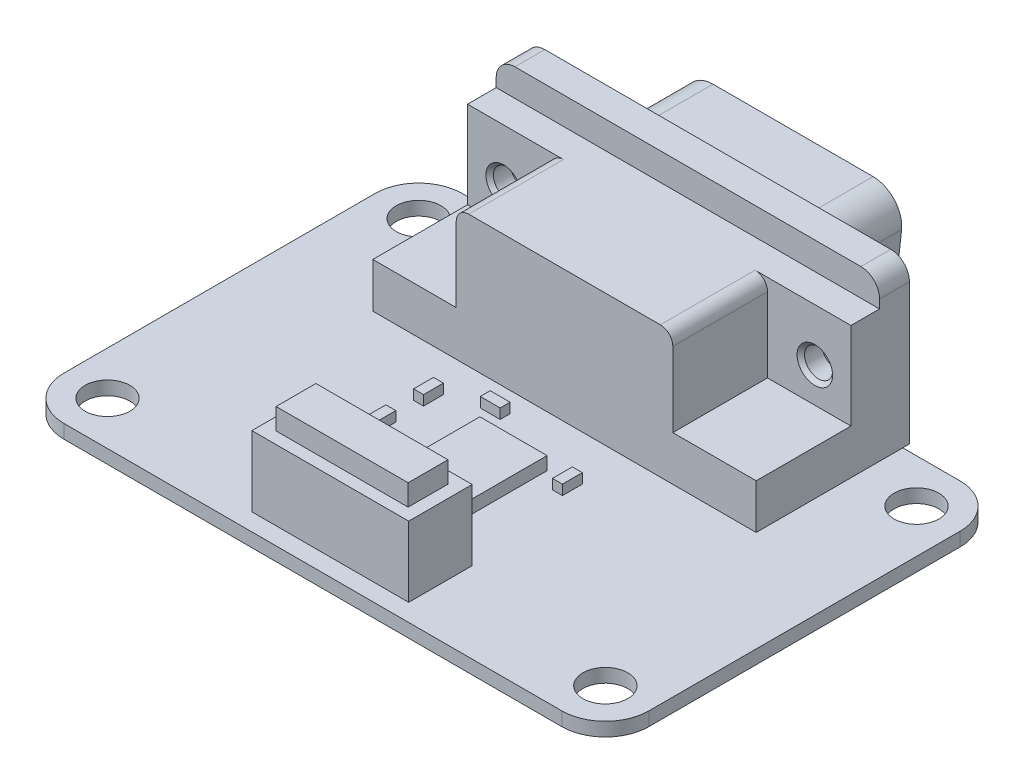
SolidWorks part; units mm, degrees
ref_plane "Front Plane" through (0, 0, 0) normal (0, 0, 1) x (1, 0, 0)
ref_plane "Top Plane" through (0, 0, 0) normal (0, 1, 0) x (1, 0, 0)
ref_plane "Right Plane" through (0, 0, 0) normal (1, 0, 0) x (0, 0, -1)
imported_body "Imported3"
sketch "Sketch1" plane through (-42.1738, 0, 0) normal (-1, 0, 0) x (0, 0, 1)
  line L0 (-17.6735, 0) -> (-15.5735, -1.8908)
  line L1 (-15.5735, -1.8908) -> (-17.6735, -1.8908)
  spline S0 degree 3 poles (-17.6735, -1.8908) (-17.6735, -1.2606) (-17.6735, -0.6303) (-17.6735, 0) knots 0 0 0 0 1 1 1 1
extrude "Boss-Extrude1" add sketch "Sketch1" along normal blind 2.1
sketch "Sketch2" plane through (-44.2738, 0, 0) normal (-1, 0, 0) x (0, 0, 1)
  line L0 (-17.6735, -1.8908) -> (-15.5735, -1.8908)
  line L1 (-15.5735, -1.8908) -> (-17.6735, 0)
  spline S0 degree 3 poles (-17.6735, -1.8908) (-17.6735, -1.2606) (-17.6735, -0.6303) (-17.6735, 0) knots 0 0 0 0 1 1 1 1
extrude "Cut-Extrude1" cut sketch "Sketch2" against normal blind 2.1
sketch "Sketch3" plane through (-16.7738, 0, 0) normal (-1, 0, 0) x (0, 0, 1)
  line L0 (-12.7235, -1.8908) -> (-14.8235, -1.8908)
  line L1 (-14.8235, -1.8908) -> (-12.7235, 0)
  spline S0 degree 3 poles (-12.7235, -1.8908) (-12.7235, -1.2606) (-12.7235, -0.6303) (-12.7235, 0) knots 0 0 0 0 1 1 1 1
extrude "Boss-Extrude2" add sketch "Sketch3" along normal blind 2.1
sketch "Sketch4" plane through (-18.8738, 0, 0) normal (-1, 0, 0) x (0, 0, 1)
  line L0 (-14.8235, -1.8908) -> (-12.7235, -1.8908)
  line L1 (-12.7235, 0) -> (-14.8235, -1.8908)
  spline S0 degree 3 poles (-12.7235, -1.8908) (-12.7235, -1.2606) (-12.7235, -0.6303) (-12.7235, 0) knots 0 0 0 0 1 1 1 1
extrude "Cut-Extrude2" cut sketch "Sketch4" against normal blind 2.1
sketch "Sketch5" plane through (-16.7738, 0, 0) normal (-1, 0, 0) x (0, 0, 1)
  line L0 (-15.5735, -1.8908) -> (-17.6735, -1.8908)
  line L1 (-17.6735, 0) -> (-15.5735, -1.8908)
  spline S0 degree 3 poles (-17.6735, -1.8908) (-17.6735, -1.2606) (-17.6735, -0.6303) (-17.6735, 0) knots 0 0 0 0 1 1 1 1
extrude "Boss-Extrude3" add sketch "Sketch5" along normal blind 2.1
sketch "Sketch6" plane through (-18.8738, 0, 0) normal (-1, 0, 0) x (0, 0, 1)
  line L0 (-17.6735, -1.8908) -> (-15.5735, -1.8908)
  line L1 (-15.5735, -1.8908) -> (-17.6735, 0)
  spline S0 degree 3 poles (-17.6735, -1.8908) (-17.6735, -1.2606) (-17.6735, -0.6303) (-17.6735, 0) knots 0 0 0 0 1 1 1 1
extrude "Cut-Extrude3" cut sketch "Sketch6" against normal blind 2.1
sketch "Sketch7" plane through (-13.6738, 0, 0) normal (1, 0, 0) x (0, 0, -1)
  line L0 (17.6735, -1.8908) -> (15.5735, -1.8908)
  line L1 (15.5735, -1.8908) -> (17.6735, 0)
  spline S0 degree 3 poles (17.6735, -1.8908) (17.6735, -1.2606) (17.6735, -0.6303) (17.6735, 0) knots 0 0 0 0 1 1 1 1
extrude "Boss-Extrude4" add sketch "Sketch7" along normal blind 2.1
sketch "Sketch8" plane through (-11.5738, 0, 0) normal (1, 0, 0) x (0, 0, -1)
  line L0 (15.5735, -1.8908) -> (17.6735, -1.8908)
  line L1 (17.6735, 0) -> (15.5735, -1.8908)
  spline S0 degree 3 poles (17.6735, -1.8908) (17.6735, -1.2606) (17.6735, -0.6303) (17.6735, 0) knots 0 0 0 0 1 1 1 1
extrude "Cut-Extrude4" cut sketch "Sketch8" against normal blind 2.1
sketch "Sketch9" plane through (-13.6738, 0, 0) normal (1, 0, 0) x (0, 0, -1)
  line L0 (12.7235, 0) -> (14.8235, -1.8908)
  line L1 (14.8235, -1.8908) -> (12.7235, -1.8908)
  spline S0 degree 3 poles (12.7235, -1.8908) (12.7235, -1.2606) (12.7235, -0.6303) (12.7235, 0) knots 0 0 0 0 1 1 1 1
extrude "Boss-Extrude5" add sketch "Sketch9" along normal blind 2.1
sketch "Sketch10" plane through (-11.5738, 0, 0) normal (1, 0, 0) x (0, 0, -1)
  line L0 (12.7235, -1.8908) -> (14.8235, -1.8908)
  line L1 (14.8235, -1.8908) -> (12.7235, 0)
  spline S0 degree 3 poles (12.7235, -1.8908) (12.7235, -1.2606) (12.7235, -0.6303) (12.7235, 0) knots 0 0 0 0 1 1 1 1
extrude "Cut-Extrude5" cut sketch "Sketch10" against normal blind 2.1
sketch "Sketch11" plane through (-13.6738, 0, 0) normal (1, 0, 0) x (0, 0, -1)
  line L0 (12.7235, -1.8908) -> (14.8235, -1.8908)
  line L1 (14.8235, -1.8908) -> (12.7235, 0)
  spline S0 degree 3 poles (12.7235, -1.8908) (12.7235, -1.2606) (12.7235, -0.6303) (12.7235, 0) knots 0 0 0 0 1 1 1 1
extrude "Cut-Extrude6" cut sketch "Sketch11" against normal blind 0.6745
sketch "Sketch12" plane through (-14.3483, 0, 0) normal (1, 0, 0) x (0, 0, -1)
  line L0 (12.7235, -1.8908) -> (14.8235, -1.8908)
  line L1 (14.8235, -1.8908) -> (12.7235, 0)
  spline S0 degree 3 poles (12.7235, -1.8908) (12.7235, -1.2606) (12.7235, -0.6303) (12.7235, 0) knots 0 0 0 0 1 1 1 1
extrude "Cut-Extrude7" cut sketch "Sketch12" against normal blind 0.3255
sketch "Sketch13" plane through (-39.0738, 0, 0) normal (1, 0, 0) x (0, 0, -1)
  line L0 (12.7235, 0) -> (14.8235, -1.8908)
  line L1 (14.8235, -1.8908) -> (12.7235, -1.8908)
  spline S0 degree 3 poles (12.7235, -1.8908) (12.7235, -1.2606) (12.7235, -0.6303) (12.7235, 0) knots 0 0 0 0 1 1 1 1
extrude "Boss-Extrude6" add sketch "Sketch13" along normal blind 2.1
sketch "Sketch14" plane through (-36.9738, 0, 0) normal (1, 0, 0) x (0, 0, -1)
  line L0 (12.7235, -1.8908) -> (14.8235, -1.8908)
  line L1 (14.8235, -1.8908) -> (12.7235, 0)
  spline S0 degree 3 poles (12.7235, -1.8908) (12.7235, -1.2606) (12.7235, -0.6303) (12.7235, 0) knots 0 0 0 0 1 1 1 1
extrude "Cut-Extrude8" cut sketch "Sketch14" against normal blind 2.1
sketch "Sketch15" plane through (-42.1738, 0, 0) normal (-1, 0, 0) x (0, 0, 1)
  line L0 (-14.8235, -1.8908) -> (-12.7235, 0)
  line L1 (-12.7235, -1.8908) -> (-14.8235, -1.8908)
  spline S0 degree 3 poles (-12.7235, -1.8908) (-12.7235, -1.2606) (-12.7235, -0.6303) (-12.7235, 0) knots 0 0 0 0 1 1 1 1
extrude "Boss-Extrude7" add sketch "Sketch15" along normal blind 2.1
sketch "Sketch16" plane through (-44.2738, 0, 0) normal (-1, 0, 0) x (0, 0, 1)
  line L0 (-12.7235, 0) -> (-14.8235, -1.8908)
  line L1 (-14.8235, -1.8908) -> (-12.7235, -1.8908)
  spline S0 degree 3 poles (-12.7235, -1.8908) (-12.7235, -1.2606) (-12.7235, -0.6303) (-12.7235, 0) knots 0 0 0 0 1 1 1 1
extrude "Cut-Extrude9" cut sketch "Sketch16" against normal blind 2.1
sketch "Sketch17" plane through (-11.5738, 0, 0) normal (1, 0, 0) x (0, 0, -1)
  line L0 (12.7235, 1.1) -> (17.6735, 1.1)
  line L1 (17.6735, 1.1) -> (17.6735, 0)
  line L2 (17.6735, 0) -> (12.7235, 0)
  line L3 (12.7235, 0) -> (12.7235, 1.1)
extrude "Boss-Extrude8" add sketch "Sketch17" along normal blind 7.15
sketch "Sketch18" plane through (-39.0738, 0, 0) normal (1, 0, 0) x (0, 0, -1)
  line L0 (17.6735, -1.8908) -> (15.5735, -1.8908)
  line L1 (15.5735, -1.8908) -> (17.6735, 0)
  spline S0 degree 3 poles (17.6735, -1.8908) (17.6735, -1.2606) (17.6735, -0.6303) (17.6735, 0) knots 0 0 0 0 1 1 1 1
extrude "Boss-Extrude9" add sketch "Sketch18" along normal blind 2.1
sketch "Sketch19" plane through (-36.9738, 0, 0) normal (1, 0, 0) x (0, 0, -1)
  line L0 (15.5735, -1.8908) -> (17.6735, -1.8908)
  line L1 (17.6735, 0) -> (15.5735, -1.8908)
  spline S0 degree 3 poles (17.6735, -1.8908) (17.6735, -1.2606) (17.6735, -0.6303) (17.6735, 0) knots 0 0 0 0 1 1 1 1
extrude "Cut-Extrude10" cut sketch "Sketch19" against normal blind 2.1
sketch "Sketch20" plane through (-39.0738, 0, 0) normal (1, 0, 0) x (0, 0, -1)
  line L0 (15.5735, -1.8908) -> (17.6735, -1.8908)
  line L1 (17.6735, 0) -> (15.5735, -1.8908)
  spline S0 degree 3 poles (17.6735, -1.8908) (17.6735, -1.2606) (17.6735, -0.6303) (17.6735, 0) knots 0 0 0 0 1 1 1 1
extrude "Cut-Extrude11" cut sketch "Sketch20" against normal blind 0.6745
sketch "Sketch21" plane through (-39.7483, 0, 0) normal (1, 0, 0) x (0, 0, -1)
  line L0 (15.5735, -1.8908) -> (17.6735, -1.8908)
  line L1 (17.6735, 0) -> (15.5735, -1.8908)
  spline S0 degree 3 poles (17.6735, -1.8908) (17.6735, -1.2606) (17.6735, -0.6303) (17.6735, 0) knots 0 0 0 0 1 1 1 1
extrude "Cut-Extrude12" cut sketch "Sketch21" against normal blind 0.3255
sketch "Sketch22" plane through (0, -1.8908, 0) normal (0, -1, 0) x (1, 0, 0)
  line L0 (-42.1738, -14.8235) -> (-42.1738, -12.7235)
  line L1 (-41.1738, -12.7235) -> (-40.0738, -12.7235)
  line L2 (-39.0738, -12.7235) -> (-39.0738, -14.8235)
  line L3 (-39.7483, -15.5735) -> (-40.0738, -15.5735)
  line L4 (-40.0738, -15.5735) -> (-40.0738, -17.6735)
  line L5 (-40.0738, -17.6735) -> (-41.1738, -17.6735)
  line L6 (-42.1738, -17.6735) -> (-42.1738, -15.5735)
  spline S0 degree 3 poles (-42.1738, -15.5735) (-42.1738, -15.3235) (-42.1738, -15.0735) (-42.1738, -14.8235) knots 0 0 0 0 1 1 1 1
  spline S1 degree 3 poles (-42.1738, -12.7235) (-41.9489, -12.7235) (-41.7241, -12.7235) (-41.4993, -12.7235) knots 0 0 0 0 1 1 1 1
  spline S2 degree 3 poles (-41.4993, -12.7235) (-41.3908, -12.7235) (-41.2823, -12.7235) (-41.1738, -12.7235) knots 0 0 0 0 1 1 1 1
  spline S3 degree 3 poles (-39.7483, -12.7235) (-39.8568, -12.7235) (-39.9653, -12.7235) (-40.0738, -12.7235) knots 0 0 0 0 1 1 1 1
  spline S4 degree 3 poles (-39.0738, -12.7235) (-39.2986, -12.7235) (-39.5235, -12.7235) (-39.7483, -12.7235) knots 0 0 0 0 1 1 1 1
  spline S5 degree 3 poles (-39.0738, -15.5735) (-39.0738, -15.3235) (-39.0738, -15.0735) (-39.0738, -14.8235) knots 0 0 0 0 1 1 1 1
  spline S6 degree 3 poles (-39.0738, -15.5735) (-39.2986, -15.5735) (-39.5235, -15.5735) (-39.7483, -15.5735) knots 0 0 0 0 1 1 1 1
  spline S7 degree 3 poles (-41.4993, -17.6735) (-41.3908, -17.6735) (-41.2823, -17.6735) (-41.1738, -17.6735) knots 0 0 0 0 1 1 1 1
  spline S8 degree 3 poles (-42.1738, -17.6735) (-41.9489, -17.6735) (-41.7241, -17.6735) (-41.4993, -17.6735) knots 0 0 0 0 1 1 1 1
extrude "Boss-Extrude10" add sketch "Sketch22" along normal blind 1.0092
sketch "Sketch23" plane through (-42.1738, 0, 0) normal (-1, 0, 0) x (0, 0, 1)
  line L0 (-17.6735, -2.9) -> (-15.5735, -2.9)
  line L1 (-15.5735, -2.9) -> (-15.5735, -1.8908)
  line L2 (-15.5735, -1.8908) -> (-17.6735, 0)
  spline S0 degree 3 poles (-17.6735, -1.8908) (-17.6735, -1.2606) (-17.6735, -0.6303) (-17.6735, 0) knots 0 0 0 0 1 1 1 1
  spline S1 degree 3 poles (-17.6735, -2.9) (-17.6735, -2.5636) (-17.6735, -2.2272) (-17.6735, -1.8908) knots 0 0 0 0 1 1 1 1
extrude "Cut-Extrude13" cut sketch "Sketch23" against normal blind 0.6745
sketch "Sketch24" plane through (-41.4993, 0, 0) normal (-1, 0, 0) x (0, 0, 1)
  line L0 (-17.6735, -2.9) -> (-15.5735, -2.9)
  line L1 (-15.5735, -2.9) -> (-15.5735, -1.8908)
  line L2 (-15.5735, -1.8908) -> (-17.6735, 0)
  spline S0 degree 3 poles (-17.6735, -1.8908) (-17.6735, -1.2606) (-17.6735, -0.6303) (-17.6735, 0) knots 0 0 0 0 1 1 1 1
  spline S1 degree 3 poles (-17.6735, -2.9) (-17.6735, -2.5636) (-17.6735, -2.2272) (-17.6735, -1.8908) knots 0 0 0 0 1 1 1 1
extrude "Cut-Extrude14" cut sketch "Sketch24" against normal blind 0.3255
sketch "Sketch25" plane through (0, 0, -15.5735) normal (0, 0, -1) x (-1, 0, 0)
  line L0 (39.7483, -2.9) -> (39.0738, -1.9)
  line L1 (39.0738, -1.9) -> (39.0738, -2.9)
  spline S0 degree 3 poles (39.0738, -2.9) (39.2986, -2.9) (39.5235, -2.9) (39.7483, -2.9) knots 0 0 0 0 1 1 1 1
extrude "Cut-Extrude15" cut sketch "Sketch25" against normal blind 0.75
sketch "Sketch26" plane through (0, 0, -15.5735) normal (0, 0, -1) x (-1, 0, 0)
  line L0 (42.1738, -1.9) -> (41.4993, -2.9)
  line L1 (42.1738, -2.9) -> (42.1738, -1.9)
  spline S0 degree 3 poles (42.1738, -2.9) (41.9489, -2.9) (41.7241, -2.9) (41.4993, -2.9) knots 0 0 0 0 1 1 1 1
extrude "Cut-Extrude16" cut sketch "Sketch26" against normal blind 0.75
sketch "Sketch27" plane through (-39.0738, 0, 0) normal (1, 0, 0) x (0, 0, -1)
  line L0 (12.7235, -2.9) -> (14.8235, -2.9)
  line L1 (14.8235, -2.9) -> (14.8235, -1.8908)
  line L2 (14.8235, -1.8908) -> (12.7235, 0)
  spline S0 degree 3 poles (12.7235, -1.8908) (12.7235, -1.2606) (12.7235, -0.6303) (12.7235, 0) knots 0 0 0 0 1 1 1 1
  spline S1 degree 3 poles (12.7235, -2.9) (12.7235, -2.5636) (12.7235, -2.2272) (12.7235, -1.8908) knots 0 0 0 0 1 1 1 1
extrude "Cut-Extrude17" cut sketch "Sketch27" against normal blind 0.6745
sketch "Sketch28" plane through (-39.7483, 0, 0) normal (1, 0, 0) x (0, 0, -1)
  line L0 (12.7235, -2.9) -> (14.8235, -2.9)
  line L1 (14.8235, -2.9) -> (14.8235, -1.8908)
  line L2 (14.8235, -1.8908) -> (12.7235, 0)
  spline S0 degree 3 poles (12.7235, -1.8908) (12.7235, -1.2606) (12.7235, -0.6303) (12.7235, 0) knots 0 0 0 0 1 1 1 1
  spline S1 degree 3 poles (12.7235, -2.9) (12.7235, -2.5636) (12.7235, -2.2272) (12.7235, -1.8908) knots 0 0 0 0 1 1 1 1
extrude "Cut-Extrude18" cut sketch "Sketch28" against normal blind 0.3255
sketch "Sketch29" plane through (-42.1738, 0, 0) normal (-1, 0, 0) x (0, 0, 1)
  line L0 (-12.7235, 0) -> (-14.8235, -1.8908)
  line L1 (-14.8235, -1.8908) -> (-14.8235, -2.9)
  line L2 (-14.8235, -2.9) -> (-12.7235, -2.9)
  spline S0 degree 3 poles (-12.7235, -1.8908) (-12.7235, -1.2606) (-12.7235, -0.6303) (-12.7235, 0) knots 0 0 0 0 1 1 1 1
  spline S1 degree 3 poles (-12.7235, -2.9) (-12.7235, -2.5636) (-12.7235, -2.2272) (-12.7235, -1.8908) knots 0 0 0 0 1 1 1 1
extrude "Cut-Extrude19" cut sketch "Sketch29" against normal blind 0.6745
sketch "Sketch30" plane through (-41.4993, 0, 0) normal (-1, 0, 0) x (0, 0, 1)
  line L0 (-12.7235, 0) -> (-14.8235, -1.8908)
  line L1 (-14.8235, -1.8908) -> (-14.8235, -2.9)
  line L2 (-14.8235, -2.9) -> (-12.7235, -2.9)
  spline S0 degree 3 poles (-12.7235, -1.8908) (-12.7235, -1.2606) (-12.7235, -0.6303) (-12.7235, 0) knots 0 0 0 0 1 1 1 1
  spline S1 degree 3 poles (-12.7235, -2.9) (-12.7235, -2.5636) (-12.7235, -2.2272) (-12.7235, -1.8908) knots 0 0 0 0 1 1 1 1
extrude "Cut-Extrude20" cut sketch "Sketch30" against normal blind 0.3255
sketch "Sketch31" plane through (0, -1.8908, 0) normal (0, -1, 0) x (1, 0, 0)
  line L0 (-13.6738, -15.5735) -> (-13.6738, -17.6735)
  line L1 (-14.6738, -17.6735) -> (-15.7738, -17.6735)
  line L2 (-16.7738, -17.6735) -> (-16.7738, -15.5735)
  line L3 (-16.7738, -14.8235) -> (-16.7738, -12.7235)
  line L4 (-15.7738, -12.7235) -> (-14.6738, -12.7235)
  line L5 (-14.6738, -12.7235) -> (-14.6738, -14.8235)
  line L6 (-14.6738, -14.8235) -> (-14.3483, -14.8235)
  spline S0 degree 3 poles (-13.6738, -14.8235) (-13.8986, -14.8235) (-14.1235, -14.8235) (-14.3483, -14.8235) knots 0 0 0 0 1 1 1 1
  spline S1 degree 3 poles (-13.6738, -14.8235) (-13.6738, -15.0735) (-13.6738, -15.3235) (-13.6738, -15.5735) knots 0 0 0 0 1 1 1 1
  spline S2 degree 3 poles (-13.6738, -17.6735) (-13.8986, -17.6735) (-14.1235, -17.6735) (-14.3483, -17.6735) knots 0 0 0 0 1 1 1 1
  spline S3 degree 3 poles (-14.3483, -17.6735) (-14.4568, -17.6735) (-14.5653, -17.6735) (-14.6738, -17.6735) knots 0 0 0 0 1 1 1 1
  spline S4 degree 3 poles (-16.0993, -17.6735) (-15.9908, -17.6735) (-15.8823, -17.6735) (-15.7738, -17.6735) knots 0 0 0 0 1 1 1 1
  spline S5 degree 3 poles (-16.7738, -17.6735) (-16.5489, -17.6735) (-16.3241, -17.6735) (-16.0993, -17.6735) knots 0 0 0 0 1 1 1 1
  spline S6 degree 3 poles (-16.7738, -15.5735) (-16.7738, -15.3235) (-16.7738, -15.0735) (-16.7738, -14.8235) knots 0 0 0 0 1 1 1 1
  spline S7 degree 3 poles (-16.7738, -12.7235) (-16.5489, -12.7235) (-16.3241, -12.7235) (-16.0993, -12.7235) knots 0 0 0 0 1 1 1 1
  spline S8 degree 3 poles (-16.0993, -12.7235) (-15.9908, -12.7235) (-15.8823, -12.7235) (-15.7738, -12.7235) knots 0 0 0 0 1 1 1 1
extrude "Boss-Extrude11" add sketch "Sketch31" along normal blind 1.0092
sketch "Sketch32" plane through (-16.7738, 0, 0) normal (-1, 0, 0) x (0, 0, 1)
  line L0 (-17.6735, -2.9) -> (-15.5735, -2.9)
  line L1 (-15.5735, -2.9) -> (-15.5735, -1.8908)
  line L2 (-15.5735, -1.8908) -> (-17.6735, 0)
  spline S0 degree 3 poles (-17.6735, -1.8908) (-17.6735, -1.2606) (-17.6735, -0.6303) (-17.6735, 0) knots 0 0 0 0 1 1 1 1
  spline S1 degree 3 poles (-17.6735, -2.9) (-17.6735, -2.5636) (-17.6735, -2.2272) (-17.6735, -1.8908) knots 0 0 0 0 1 1 1 1
extrude "Cut-Extrude21" cut sketch "Sketch32" against normal blind 0.6745
sketch "Sketch33" plane through (-16.0993, 0, 0) normal (-1, 0, 0) x (0, 0, 1)
  line L0 (-17.6735, -2.9) -> (-15.5735, -2.9)
  line L1 (-15.5735, -2.9) -> (-15.5735, -1.8908)
  line L2 (-15.5735, -1.8908) -> (-17.6735, 0)
  spline S0 degree 3 poles (-17.6735, -1.8908) (-17.6735, -1.2606) (-17.6735, -0.6303) (-17.6735, 0) knots 0 0 0 0 1 1 1 1
  spline S1 degree 3 poles (-17.6735, -2.9) (-17.6735, -2.5636) (-17.6735, -2.2272) (-17.6735, -1.8908) knots 0 0 0 0 1 1 1 1
extrude "Cut-Extrude22" cut sketch "Sketch33" against normal blind 0.3255
sketch "Sketch34" plane through (0, 0, -14.8235) normal (0, 0, 1) x (1, 0, 0)
  line L0 (-13.6738, -2.9) -> (-13.6738, -1.9)
  line L1 (-13.6738, -1.9) -> (-14.3483, -2.9)
  spline S0 degree 3 poles (-13.6738, -2.9) (-13.8986, -2.9) (-14.1235, -2.9) (-14.3483, -2.9) knots 0 0 0 0 1 1 1 1
extrude "Cut-Extrude23" cut sketch "Sketch34" against normal blind 0.75
sketch "Sketch35" plane through (0, 0, -15.5735) normal (0, 0, -1) x (-1, 0, 0)
  line L0 (16.7738, -2.9) -> (16.7738, -1.9)
  line L1 (16.7738, -1.9) -> (16.0993, -2.9)
  spline S0 degree 3 poles (16.7738, -2.9) (16.5489, -2.9) (16.3241, -2.9) (16.0993, -2.9) knots 0 0 0 0 1 1 1 1
extrude "Cut-Extrude24" cut sketch "Sketch35" against normal blind 0.75
sketch "Sketch36" plane through (-13.6738, 0, 0) normal (1, 0, 0) x (0, 0, -1)
  line L0 (17.6735, 0) -> (15.5735, -1.8908)
  line L1 (15.5735, -1.8908) -> (15.5735, -2.9)
  line L2 (15.5735, -2.9) -> (17.6735, -2.9)
  spline S0 degree 3 poles (17.6735, -1.8908) (17.6735, -1.2606) (17.6735, -0.6303) (17.6735, 0) knots 0 0 0 0 1 1 1 1
  spline S1 degree 3 poles (17.6735, -2.9) (17.6735, -2.5636) (17.6735, -2.2272) (17.6735, -1.8908) knots 0 0 0 0 1 1 1 1
extrude "Cut-Extrude25" cut sketch "Sketch36" against normal blind 0.6745
sketch "Sketch37" plane through (-14.3483, 0, 0) normal (1, 0, 0) x (0, 0, -1)
  line L0 (17.6735, 0) -> (15.5735, -1.8908)
  line L1 (15.5735, -1.8908) -> (15.5735, -2.9)
  line L2 (15.5735, -2.9) -> (17.6735, -2.9)
  spline S0 degree 3 poles (17.6735, -1.8908) (17.6735, -1.2606) (17.6735, -0.6303) (17.6735, 0) knots 0 0 0 0 1 1 1 1
  spline S1 degree 3 poles (17.6735, -2.9) (17.6735, -2.5636) (17.6735, -2.2272) (17.6735, -1.8908) knots 0 0 0 0 1 1 1 1
extrude "Cut-Extrude26" cut sketch "Sketch37" against normal blind 0.3255
sketch "Sketch38" plane through (-16.7738, 0, 0) normal (-1, 0, 0) x (0, 0, 1)
  line L0 (-12.7235, 0) -> (-14.8235, -1.8908)
  line L1 (-14.8235, -1.8908) -> (-14.8235, -2.9)
  line L2 (-14.8235, -2.9) -> (-12.7235, -2.9)
  spline S0 degree 3 poles (-12.7235, -1.8908) (-12.7235, -1.2606) (-12.7235, -0.6303) (-12.7235, 0) knots 0 0 0 0 1 1 1 1
  spline S1 degree 3 poles (-12.7235, -2.9) (-12.7235, -2.5636) (-12.7235, -2.2272) (-12.7235, -1.8908) knots 0 0 0 0 1 1 1 1
extrude "Cut-Extrude27" cut sketch "Sketch38" against normal blind 0.6745
sketch "Sketch39" plane through (-16.0993, 0, 0) normal (-1, 0, 0) x (0, 0, 1)
  line L0 (-12.7235, 0) -> (-14.8235, -1.8908)
  line L1 (-14.8235, -1.8908) -> (-14.8235, -2.9)
  line L2 (-14.8235, -2.9) -> (-12.7235, -2.9)
  spline S0 degree 3 poles (-12.7235, -1.8908) (-12.7235, -1.2606) (-12.7235, -0.6303) (-12.7235, 0) knots 0 0 0 0 1 1 1 1
  spline S1 degree 3 poles (-12.7235, -2.9) (-12.7235, -2.5636) (-12.7235, -2.2272) (-12.7235, -1.8908) knots 0 0 0 0 1 1 1 1
extrude "Cut-Extrude28" cut sketch "Sketch39" against normal blind 0.3255
sketch "Sketch40" plane through (0, -2.9, 0) normal (0, -1, 0) x (1, 0, 0)
  line L0 (-14.6738, -14.8235) -> (-14.6738, -12.7235)
  line L1 (-14.6738, -12.7235) -> (-15.7738, -12.7235)
  line L2 (-15.7738, -12.7235) -> (-15.7738, -14.8235)
  line L3 (-15.7738, -14.8235) -> (-15.7738, -15.5735)
  line L4 (-15.7738, -15.5735) -> (-15.7738, -17.6735)
  line L5 (-15.7738, -17.6735) -> (-14.6738, -17.6735)
  line L6 (-14.6738, -17.6735) -> (-14.6738, -15.5735)
  line L7 (-14.6738, -15.5735) -> (-14.6738, -14.8235)
extrude "Cut-Extrude29" cut sketch "Sketch40" against normal blind 1.0092
sketch "Sketch41" plane through (0, -1.8908, 0) normal (0, -1, 0) x (1, 0, 0)
  line L0 (-14.6738, -17.6735) -> (-14.6738, -12.7235)
  line L1 (-14.6738, -12.7235) -> (-15.7738, -12.7235)
  line L2 (-15.7738, -12.7235) -> (-15.7738, -17.6735)
  line L3 (-15.7738, -17.6735) -> (-14.6738, -17.6735)
extrude "Cut-Extrude30" cut sketch "Sketch41" against normal blind 1.8908
sketch "Sketch42" plane through (0, -2.9, 0) normal (0, -1, 0) x (1, 0, 0)
  line L0 (-40.0738, -14.8235) -> (-40.0738, -12.7235)
  line L1 (-40.0738, -12.7235) -> (-41.1738, -12.7235)
  line L2 (-41.1738, -12.7235) -> (-41.1738, -14.8235)
  line L3 (-41.1738, -14.8235) -> (-41.1738, -15.5735)
  line L4 (-41.1738, -15.5735) -> (-41.1738, -17.6735)
  line L5 (-41.1738, -17.6735) -> (-40.0738, -17.6735)
  line L6 (-40.0738, -17.6735) -> (-40.0738, -15.5735)
  line L7 (-40.0738, -15.5735) -> (-40.0738, -14.8235)
extrude "Cut-Extrude31" cut sketch "Sketch42" against normal blind 1.0092
sketch "Sketch43" plane through (0, -1.8908, 0) normal (0, -1, 0) x (1, 0, 0)
  line L0 (-40.0738, -17.6735) -> (-40.0738, -12.7235)
  line L1 (-40.0738, -12.7235) -> (-41.1738, -12.7235)
  line L2 (-41.1738, -12.7235) -> (-41.1738, -17.6735)
  line L3 (-41.1738, -17.6735) -> (-40.0738, -17.6735)
extrude "Cut-Extrude32" cut sketch "Sketch43" against normal blind 1.8908
sketch "Sketch44" plane through (0, 0, -12.7235) normal (0, 0, 1) x (1, 0, 0)
  line L0 (-44.2738, 1.1) -> (-4.4238, 1.1)
  line L1 (-4.4238, 1.1) -> (-4.4238, 0)
  line L2 (-4.4238, 0) -> (-44.2738, 0)
  line L3 (-44.2738, 0) -> (-44.2738, 1.1)
extrude "Boss-Extrude12" add sketch "Sketch44" along normal blind 20.45
sketch "Sketch45" plane through (0, 0, -17.6735) normal (0, 0, -1) x (-1, 0, 0)
  line L0 (44.2738, 0) -> (4.4238, 0)
  line L1 (4.4238, 0) -> (4.4238, 1.1)
  line L2 (4.4238, 1.1) -> (44.2738, 1.1)
  line L3 (44.2738, 1.1) -> (44.2738, 0)
extrude "Boss-Extrude13" add sketch "Sketch45" along normal blind 6.6
sketch "Sketch46" plane through (-44.2738, 0, 0) normal (-1, 0, 0) x (0, 0, 1)
  line L0 (-24.2735, 1.1) -> (7.7265, 1.1)
  line L1 (7.7265, 1.1) -> (7.7265, 0)
  line L2 (7.7265, 0) -> (-24.2735, 0)
  line L3 (-24.2735, 0) -> (-24.2735, 1.1)
extrude "Boss-Extrude14" add sketch "Sketch46" along normal blind 7.15
sketch "Sketch47" plane through (0, 1.1, 0) normal (0, 1, 0) x (-1, 0, 0)
  line L0 (43.3238, -12.4935) -> (43.3238, -24.8035)
  line L1 (43.3238, -24.8035) -> (12.5238, -24.8035)
  line L2 (12.5238, -24.8035) -> (12.5238, -12.4935)
  line L3 (12.5238, -12.4935) -> (43.3238, -12.4935)
extrude "Boss-Extrude15" add sketch "Sketch47" along normal blind 12.8
sketch "Sketch48" plane through (-43.3238, 0, 0) normal (-1, 0, 0) x (0, 0, 1)
  line L0 (-22.4035, 13.9) -> (-22.4035, 11.7)
  line L1 (-22.4035, 11.7) -> (-12.4935, 11.7)
  line L2 (-12.4935, 11.7) -> (-12.4935, 13.9)
  line L3 (-12.4935, 13.9) -> (-22.4035, 13.9)
extrude "Cut-Extrude33" cut sketch "Sketch48" against normal through all
sketch "Sketch49" plane through (0, 11.7, 0) normal (0, 1, 0) x (-1, 0, 0)
  line L0 (12.5238, -12.4935) -> (12.5238, -20.1035)
  line L1 (12.5238, -20.1035) -> (19.2238, -20.1035)
  line L2 (19.2238, -20.1035) -> (19.2238, -12.4935)
  line L3 (19.2238, -12.4935) -> (12.5238, -12.4935)
extrude "Cut-Extrude34" cut sketch "Sketch49" against normal blind 7
sketch "Sketch50" plane through (0, 11.7, 0) normal (0, 1, 0) x (-1, 0, 0)
  line L0 (43.3238, -12.4935) -> (36.6238, -12.4935)
  line L1 (36.6238, -12.4935) -> (36.6238, -20.1035)
  line L2 (36.6238, -20.1035) -> (43.3238, -20.1035)
  line L3 (43.3238, -20.1035) -> (43.3238, -12.4935)
extrude "Cut-Extrude35" cut sketch "Sketch50" against normal blind 7
sketch "Sketch51" plane through (0, 1.1, 0) normal (0, 1, 0) x (-1, 0, 0)
  line L0 (21.6238, 1.2265) -> (21.6238, 6.3265)
  line L1 (21.6238, 6.3265) -> (34.2238, 6.3265)
  line L2 (34.2238, 6.3265) -> (34.2238, 1.2265)
  line L3 (34.2238, 1.2265) -> (21.6238, 1.2265)
extrude "Boss-Extrude16" add sketch "Sketch51" along normal blind 5.65
sketch "Sketch52" plane through (0, 6.75, 0) normal (0, 1, 0) x (-1, 0, 0)
  line L0 (33.2288, 2.1765) -> (22.6188, 2.1765)
  line L1 (22.6188, 2.1765) -> (22.6188, 5.3765)
  line L2 (22.6188, 5.3765) -> (33.2288, 5.3765)
  line L3 (33.2288, 5.3765) -> (33.2288, 2.1765)
extrude "Boss-Extrude17" add sketch "Sketch52" along normal blind 1.7
sketch "Sketch53" plane through (0, 1.1, 0) normal (0, 1, 0) x (-1, 0, 0)
  line L0 (34.6838, -4.0985) -> (35.4838, -4.0985)
  line L1 (35.4838, -4.0985) -> (35.4838, -5.6985)
  line L2 (35.4838, -5.6985) -> (34.6838, -5.6985)
  line L3 (34.6838, -5.6985) -> (34.6838, -4.0985)
extrude "Boss-Extrude18" add sketch "Sketch53" along normal blind 0.8
sketch "Sketch54" plane through (0, 1.1, 0) normal (0, 1, 0) x (-1, 0, 0)
  line L0 (35.4838, -1.8735) -> (34.6838, -1.8735)
  line L1 (34.6838, -1.8735) -> (34.6838, -0.2735)
  line L2 (34.6838, -0.2735) -> (35.4838, -0.2735)
  line L3 (35.4838, -0.2735) -> (35.4838, -1.8735)
extrude "Boss-Extrude19" add sketch "Sketch54" along normal blind 0.8
sketch "Sketch55" plane through (0, 1.1, 0) normal (0, 1, 0) x (-1, 0, 0)
  line L0 (25.2238, -8.3935) -> (25.2238, -1.9935)
  line L1 (25.2238, -1.9935) -> (30.6238, -1.9935)
  line L2 (30.6238, -1.9935) -> (30.6238, -8.3935)
  line L3 (30.6238, -8.3935) -> (25.2238, -8.3935)
extrude "Boss-Extrude20" add sketch "Sketch55" along normal blind 1.05
sketch "Sketch56" plane through (0, 1.1, 0) normal (0, 1, 0) x (-1, 0, 0)
  line L0 (34.6838, -7.9235) -> (35.4838, -7.9235)
  line L1 (35.4838, -7.9235) -> (35.4838, -9.5235)
  line L2 (35.4838, -9.5235) -> (34.6838, -9.5235)
  line L3 (34.6838, -9.5235) -> (34.6838, -7.9235)
extrude "Boss-Extrude21" add sketch "Sketch56" along normal blind 0.8
sketch "Sketch57" plane through (0, 1.1, 0) normal (0, 1, 0) x (-1, 0, 0)
  line L0 (30.6738, -10.8735) -> (30.6738, -10.0735)
  line L1 (30.6738, -10.0735) -> (32.2738, -10.0735)
  line L2 (32.2738, -10.0735) -> (32.2738, -10.8735)
  line L3 (32.2738, -10.8735) -> (30.6738, -10.8735)
extrude "Boss-Extrude22" add sketch "Sketch57" along normal blind 0.8
sketch "Sketch58" plane through (0, 1.1, 0) normal (0, 1, 0) x (-1, 0, 0)
  line L0 (22.8738, -8.8735) -> (22.8738, -7.2735)
  line L1 (22.8738, -7.2735) -> (23.6738, -7.2735)
  line L2 (23.6738, -7.2735) -> (23.6738, -8.8735)
  line L3 (23.6738, -8.8735) -> (22.8738, -8.8735)
extrude "Boss-Extrude23" add sketch "Sketch58" along normal blind 0.8
sketch "Sketch59" plane through (0, 0, 0) normal (0, -1, 0) x (1, 0, 0)
  line L0 (-33.2938, -14.3235) -> (-33.7938, -14.3235)
  line L1 (-33.7938, -14.3235) -> (-33.7938, -13.8235)
  line L2 (-33.7938, -13.8235) -> (-33.2938, -13.8235)
  line L3 (-33.2938, -13.8235) -> (-33.2938, -14.3235)
extrude "Boss-Extrude24" add sketch "Sketch59" along normal blind 2.25
sketch "Sketch60" plane through (0, 0, 0) normal (0, -1, 0) x (1, 0, 0)
  line L0 (-24.8938, -13.8235) -> (-24.8938, -14.3235)
  line L1 (-24.8938, -14.3235) -> (-25.3938, -14.3235)
  line L2 (-25.3938, -14.3235) -> (-25.3938, -13.8235)
  line L3 (-25.3938, -13.8235) -> (-24.8938, -13.8235)
extrude "Boss-Extrude25" add sketch "Sketch60" along normal blind 2.25
sketch "Sketch61" plane through (0, 0, 0) normal (0, -1, 0) x (1, 0, 0)
  line L0 (-23.4938, -16.9735) -> (-23.4938, -17.4735)
  line L1 (-23.4938, -17.4735) -> (-23.9938, -17.4735)
  line L2 (-23.9938, -17.4735) -> (-23.9938, -16.9735)
  line L3 (-23.9938, -16.9735) -> (-23.4938, -16.9735)
extrude "Boss-Extrude26" add sketch "Sketch61" along normal blind 2.25
sketch "Sketch62" plane through (0, 0, 0) normal (0, -1, 0) x (1, 0, 0)
  line L0 (-29.0938, -16.9735) -> (-29.0938, -17.4735)
  line L1 (-29.0938, -17.4735) -> (-29.5938, -17.4735)
  line L2 (-29.5938, -17.4735) -> (-29.5938, -16.9735)
  line L3 (-29.5938, -16.9735) -> (-29.0938, -16.9735)
extrude "Boss-Extrude27" add sketch "Sketch62" along normal blind 2.25
sketch "Sketch63" plane through (0, 0, 0) normal (0, -1, 0) x (1, 0, 0)
  line L0 (-30.4938, -13.8235) -> (-30.4938, -14.3235)
  line L1 (-30.4938, -14.3235) -> (-30.9938, -14.3235)
  line L2 (-30.9938, -14.3235) -> (-30.9938, -13.8235)
  line L3 (-30.9938, -13.8235) -> (-30.4938, -13.8235)
extrude "Boss-Extrude28" add sketch "Sketch63" along normal blind 2.25
sketch "Sketch64" plane through (0, 0, 0) normal (0, -1, 0) x (1, 0, 0)
  line L0 (-31.8938, -16.9735) -> (-31.8938, -17.4735)
  line L1 (-31.8938, -17.4735) -> (-32.3938, -17.4735)
  line L2 (-32.3938, -17.4735) -> (-32.3938, -16.9735)
  line L3 (-32.3938, -16.9735) -> (-31.8938, -16.9735)
extrude "Boss-Extrude29" add sketch "Sketch64" along normal blind 2.25
sketch "Sketch65" plane through (0, 0, 0) normal (0, -1, 0) x (1, 0, 0)
  line L0 (-26.2938, -16.9735) -> (-26.2938, -17.4735)
  line L1 (-26.2938, -17.4735) -> (-26.7938, -17.4735)
  line L2 (-26.7938, -17.4735) -> (-26.7938, -16.9735)
  line L3 (-26.7938, -16.9735) -> (-26.2938, -16.9735)
extrude "Boss-Extrude30" add sketch "Sketch65" along normal blind 2.25
sketch "Sketch66" plane through (0, 0, 0) normal (0, -1, 0) x (1, 0, 0)
  line L0 (-27.6938, -14.3235) -> (-28.1938, -14.3235)
  line L1 (-28.1938, -14.3235) -> (-28.1938, -13.8235)
  line L2 (-28.1938, -13.8235) -> (-27.6938, -13.8235)
  line L3 (-27.6938, -13.8235) -> (-27.6938, -14.3235)
extrude "Boss-Extrude31" add sketch "Sketch66" along normal blind 2.25
sketch "Sketch67" plane through (0, 0, 0) normal (0, -1, 0) x (1, 0, 0)
  line L0 (-22.0938, -14.3235) -> (-22.5938, -14.3235)
  line L1 (-22.5938, -14.3235) -> (-22.5938, -13.8235)
  line L2 (-22.5938, -13.8235) -> (-22.0938, -13.8235)
  line L3 (-22.0938, -13.8235) -> (-22.0938, -14.3235)
extrude "Boss-Extrude32" add sketch "Sketch67" along normal blind 2.25
sketch "Sketch68" plane through (0, 0, -24.8035) normal (0, 0, -1) x (-1, 0, 0)
  line L0 (36.9238, 12.2) -> (35.9238, 3.09)
  line L1 (35.9238, 3.09) -> (19.9238, 3.09)
  line L2 (19.9238, 3.09) -> (18.9238, 12.2)
  line L3 (18.9238, 12.2) -> (36.9238, 12.2)
extrude "Boss-Extrude33" add sketch "Sketch68" along normal blind 6.05
sketch "Sketch69" plane through (0, 0, -30.8535) normal (0, 0, -1) x (-1, 0, 0)
  line L0 (20.2375, 3.44) -> (35.6101, 3.44)
  line L1 (35.6101, 3.44) -> (36.5333, 11.85)
  line L2 (36.5333, 11.85) -> (19.3143, 11.85)
  line L3 (19.3143, 11.85) -> (20.2375, 3.44)
extrude "Cut-Extrude36" cut sketch "Sketch69" against normal blind 6.61
ref_plane "Plane1" through (0, 6.14, 0) normal (0, 1, 0) x (1, 0, 0)
sketch "Sketch70" plane through (0, 6.14, 0) normal (0, 1, 0) x (1, 0, 0)
  line L0 (-28.7738, 30.2535) -> (-29.2738, 30.2535)
  line L1 (-29.2738, 30.2535) -> (-29.2738, 24.2435)
  line L2 (-29.2738, 24.2435) -> (-28.7738, 24.2435)
  line L3 (-28.7738, 24.2435) -> (-28.7738, 30.2535)
  line L4 (-29.2738, 30.2535) -> (-29.2738, 24.2435) construction
revolve "Revolve1" add sketch "Sketch70" angle 360 about L4
ref_plane "Plane2" through (0, 9.04, 0) normal (0, 1, 0) x (1, 0, 0)
sketch "Sketch71" plane through (0, 9.04, 0) normal (0, 1, 0) x (1, 0, 0)
  line L0 (-30.1238, 30.2535) -> (-30.6238, 30.2535)
  line L1 (-30.6238, 30.2535) -> (-30.6238, 24.2435)
  line L2 (-30.6238, 24.2435) -> (-30.1238, 24.2435)
  line L3 (-30.1238, 24.2435) -> (-30.1238, 30.2535)
  line L4 (-30.6238, 30.2535) -> (-30.6238, 24.2435) construction
revolve "Revolve2" add sketch "Sketch71" angle 360 about L4
sketch "Sketch72" plane through (0, 9.04, 0) normal (0, 1, 0) x (1, 0, 0)
  line L0 (-32.8238, 30.2535) -> (-33.3238, 30.2535)
  line L1 (-33.3238, 30.2535) -> (-33.3238, 24.2435)
  line L2 (-33.3238, 24.2435) -> (-32.8238, 24.2435)
  line L3 (-32.8238, 24.2435) -> (-32.8238, 30.2535)
  line L4 (-33.3238, 30.2535) -> (-33.3238, 24.2435) construction
revolve "Revolve3" add sketch "Sketch72" angle 360 about L4
sketch "Sketch73" plane through (0, 6.14, 0) normal (0, 1, 0) x (1, 0, 0)
  line L0 (-23.3738, 30.2535) -> (-23.8738, 30.2535)
  line L1 (-23.8738, 30.2535) -> (-23.8738, 24.2435)
  line L2 (-23.8738, 24.2435) -> (-23.3738, 24.2435)
  line L3 (-23.3738, 24.2435) -> (-23.3738, 30.2535)
  line L4 (-23.8738, 30.2535) -> (-23.8738, 24.2435) construction
revolve "Revolve4" add sketch "Sketch73" angle 360 about L4
sketch "Sketch74" plane through (0, 9.04, 0) normal (0, 1, 0) x (1, 0, 0)
  line L0 (-27.4238, 30.2535) -> (-27.9238, 30.2535)
  line L1 (-27.9238, 30.2535) -> (-27.9238, 24.2435)
  line L2 (-27.9238, 24.2435) -> (-27.4238, 24.2435)
  line L3 (-27.4238, 24.2435) -> (-27.4238, 30.2535)
  line L4 (-27.9238, 30.2535) -> (-27.9238, 24.2435) construction
revolve "Revolve5" add sketch "Sketch74" angle 360 about L4
sketch "Sketch75" plane through (0, 9.04, 0) normal (0, 1, 0) x (1, 0, 0)
  line L0 (-22.0238, 30.2535) -> (-22.5238, 30.2535)
  line L1 (-22.5238, 30.2535) -> (-22.5238, 24.2435)
  line L2 (-22.5238, 24.2435) -> (-22.0238, 24.2435)
  line L3 (-22.0238, 24.2435) -> (-22.0238, 30.2535)
  line L4 (-22.5238, 30.2535) -> (-22.5238, 24.2435) construction
revolve "Revolve6" add sketch "Sketch75" angle 360 about L4
sketch "Sketch76" plane through (0, 9.04, 0) normal (0, 1, 0) x (1, 0, 0)
  line L0 (-24.7238, 30.2535) -> (-25.2238, 30.2535)
  line L1 (-25.2238, 30.2535) -> (-25.2238, 24.2435)
  line L2 (-25.2238, 24.2435) -> (-24.7238, 24.2435)
  line L3 (-24.7238, 24.2435) -> (-24.7238, 30.2535)
  line L4 (-25.2238, 30.2535) -> (-25.2238, 24.2435) construction
revolve "Revolve7" add sketch "Sketch76" angle 360 about L4
sketch "Sketch77" plane through (0, 6.14, 0) normal (0, 1, 0) x (1, 0, 0)
  line L0 (-26.0738, 30.2535) -> (-26.5738, 30.2535)
  line L1 (-26.5738, 30.2535) -> (-26.5738, 24.2435)
  line L2 (-26.5738, 24.2435) -> (-26.0738, 24.2435)
  line L3 (-26.0738, 24.2435) -> (-26.0738, 30.2535)
  line L4 (-26.5738, 30.2535) -> (-26.5738, 24.2435) construction
revolve "Revolve8" add sketch "Sketch77" angle 360 about L4
sketch "Sketch78" plane through (0, 6.14, 0) normal (0, 1, 0) x (1, 0, 0)
  line L0 (-31.4738, 30.2535) -> (-31.9738, 30.2535)
  line L1 (-31.9738, 30.2535) -> (-31.9738, 24.2435)
  line L2 (-31.9738, 24.2435) -> (-31.4738, 24.2435)
  line L3 (-31.4738, 24.2435) -> (-31.4738, 30.2535)
  line L4 (-31.9738, 30.2535) -> (-31.9738, 24.2435) construction
revolve "Revolve9" add sketch "Sketch78" angle 360 about L4
hole_wizard "Ø3.6 (3.6) Diameter Hole1" positions "Sketch80" profile "Sketch79" hole size "Ø3.6" standard "ANSI Metric"
sketch "Sketch80" plane through (0, 0, 0) normal (0, -1, 0) x (-1, 0, 0)
  point P0 (7.9238, -4.2265)
  point P1 (47.9238, 20.7735)
  point P2 (7.9238, 20.7735)
  point P3 (47.9238, -4.2265)
sketch "Sketch79" plane through (-7.9238, 0, 4.2265) normal (1, 0, 0) x (0, 0, -1)
  line L0 (0, 0) -> (0, 13.9)
  line L1 (0, 13.9) -> (1.8, 13.9)
  line L2 (1.8, 13.9) -> (1.8, 0)
  line L5 (1.8, 0) -> (0, 0)
  line L11 (0, -6.35) -> (0, 107.95) construction
  dimension "Thru Hole Dia." = 3.6
  dimension "Thru Hole Depth" = 13.9
hole_wizard "CBORE for M2 Hex Head Machine Screw1" positions "Sketch82" profile "Sketch81" counterbore size "M2" standard "ANSI Metric"
sketch "Sketch82" plane through (0, 0, -24.8035) normal (0, 0, -1) x (-1, 0, 0)
  point P0 (15.4238, 7.5)
  point P1 (40.4238, 7.5)
sketch "Sketch81" plane through (-15.4238, 7.5, -24.8035) normal (1, 0, 0) x (0, 1, 0)
  line L0 (0, 0) -> (0, 32.53)
  line L1 (0, 32.53) -> (1.125, 32.53)
  line L3 (1.125, 32.53) -> (1.125, 3)
  line L4 (1.125, 3) -> (1.6, 3)
  line L5 (1.6, 3) -> (1.6, 0)
  line L7 (1.6, 0) -> (0, 0)
  line L11 (0, -6.35) -> (0, 107.95) construction
  dimension "Thru Hole Dia." = 2.25
  dimension "Thru Hole Depth" = 32.53
  dimension "C'Bore Dia." = 3.2
  dimension "C'Bore Depth" = 3
chamfer "Chamfer1" distance 0.3 angle 45 2 edges at (-16.5488, 7.5, -20.1035) (-41.5488, 7.5, -20.1035)
fillet "Fillet1" radius 0.4 11 edges at (-31.4738, 6.14, -30.2535) (-24.7238, 9.04, -30.2535) (-30.1238, 9.04, -30.2535) (-27.4238, 9.04, -30.2535) (-28.7738, 6.14, -30.2535) (-26.0738, 6.14, -30.2535) (-22.0238, 9.04, -30.2535) (-42.0238, 7.5, -24.8035) (-23.3738, 6.14, -30.2535) (-32.8238, 9.04, -30.2535) (-17.0238, 7.5, -24.8035)
fillet "Fillet2" radius 1 10 edges at (-36.6238, 11.7, -16.2985) (-19.2238, 11.7, -16.2985)
fillet "Fillet3" radius 1.5 2 edges at (-43.3238, 13.9, -23.6035) (-12.5238, 13.9, -23.6035)
fillet "Fillet4" radius 1.95 4 edges at (-19.3143, 11.85, -27.5485) (-20.2375, 3.44, -27.5485) (-35.6101, 3.44, -27.5485) (-36.5333, 11.85, -27.5485)
fillet "Fillet5" radius 2.3 4 edges at (-18.9238, 12.2, -27.8285) (-35.9238, 3.09, -27.8285) (-36.9238, 12.2, -27.8285) (-19.9238, 3.09, -27.8285)
fillet "Fillet6" radius 3.5 4 edges at (-51.4238, 0.55, 7.7265) (-51.4238, 0.55, -24.2735) (-4.4238, 0.55, 7.7265) (-4.4238, 0.55, -24.2735)
